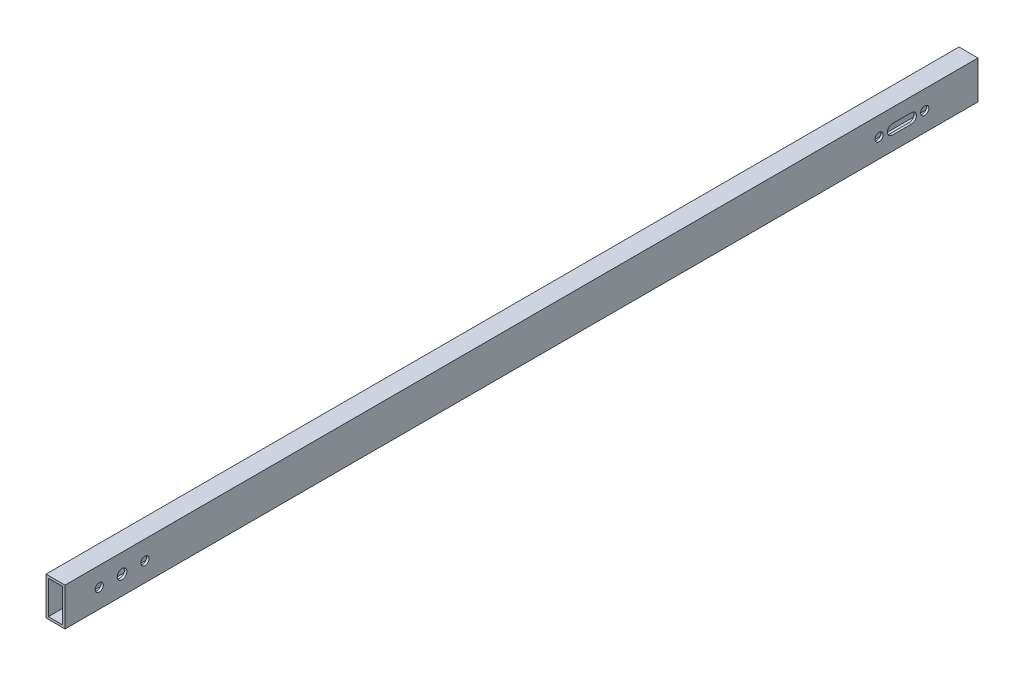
SolidWorks part; units mm, degrees
ref_plane "Front Plane" through (0, 0, 0) normal (0, 0, 1) x (1, 0, 0)
ref_plane "Top Plane" through (0, 0, 0) normal (0, 1, 0) x (1, 0, 0)
ref_plane "Right Plane" through (0, 0, 0) normal (1, 0, 0) x (0, 0, -1)
sketch "Sketch1" plane through (0, 0, 0) normal (0, 0, 1) x (1, 0, 0)
  line L1 (-6.35, -12.7) -> (6.35, -12.7)
  line L2 (-6.35, -12.7) -> (-6.35, 12.7)
  line L3 (-6.35, 12.7) -> (6.35, 12.7)
  line L4 (6.35, -12.7) -> (6.35, 12.7)
  line L6 (-6.35, 12.7) -> (6.35, -12.7) construction
  line L7 (-4.7625, -11.1125) -> (4.7625, -11.1125)
  line L8 (-4.7625, -11.1125) -> (-4.7625, 11.1125)
  line L9 (-4.7625, 11.1125) -> (4.7625, 11.1125)
  line L10 (4.7625, -11.1125) -> (4.7625, 11.1125)
  line L11 (-4.7625, -11.1125) -> (4.7625, 11.1125) construction
  line L12 (-4.7625, 11.1125) -> (4.7625, -11.1125) construction
  point P0 (0, 0)
  point P6 (0, 0)
  dimension "D1" = 25.4
  dimension "D2" = 1.5875
  dimension "D3" = 12.7
  dimension "D4" = 1.5875
  dimension "D5" = 1.5875
extrude "Boss-Extrude1" add sketch "Sketch1" along normal blind 609.6
sketch "Sketch2" plane through (6.35, 0, 0) normal (1, 0, 0) x (0, 0, -1)
  line L0 (-609.6, 0) -> (0, 0) construction
  line L1 (-609.6, -12.7) -> (-609.6, 12.7) construction
  line L2 (-571.5, 12.7) -> (-571.5, -12.7) construction
  line L3 (-44.45, 0) -> (-57.15, 0) construction
  line L4 (-44.45, -3.302) -> (-57.15, -3.302)
  line L5 (-44.45, 3.302) -> (-57.15, 3.302)
  line L6 (-609.6, 12.7) -> (0, 12.7) construction
  line L7 (-609.6, -12.7) -> (0, -12.7) construction
  line L8 (-50.8, 12.7) -> (-50.8, -12.7) construction
  circle A0 centre (-571.5, 0) radius 3.25
  arc A2 (-44.45, -3.302) -> (-44.45, 3.302) centre (-44.45, 0) ccw
  arc A3 (-57.15, 3.302) -> (-57.15, -3.302) centre (-57.15, 0) ccw
  circle A4 centre (-586.74, 0) radius 2.75
  circle A5 centre (-556.26, 0) radius 2.75
  circle A6 centre (-66.04, 0) radius 2.75
  circle A8 centre (-35.56, 0) radius 2.75
  point P9 (-50.8, 0)
  dimension "D1" = 6.5
  dimension "D2" = 3.302
  dimension "D6" = 5.5
  dimension "D8" = 30.48
  dimension "D3" = 38.1
  dimension "D4" = 12.7
  dimension "D5" = 520.7
  dimension "D7" = 30.48
extrude "Cut-Extrude1" cut sketch "Sketch2" against normal through all
sketch "Sketch3" plane through (0, 0, 609.6) normal (0, 0, 1) x (1, 0, 0)
  line L0 (-6.35, 12.7) -> (-6.35, -12.7) construction
  line L1 (-4.7625, 11.1125) -> (-6.35, 11.1125)
  line L2 (-4.7625, 11.1125) -> (-4.7625, -11.1125)
  line L3 (-4.7625, -11.1125) -> (-6.35, -11.1125)
  line L4 (-6.35, 11.1125) -> (-6.35, -11.1125)
  line L5 (-4.7625, -11.1125) -> (4.7625, -11.1125) construction
sketch "Sketch4" plane through (-6.35, 0, 0) normal (-1, 0, 0) x (0, 0, 1)
  line L0 (35.56, 0) -> (66.04, 0) construction
  line L1 (35.56, 5) -> (66.04, 5)
  line L2 (35.56, -5) -> (66.04, -5)
  line L3 (556.26, 0) -> (586.74, 0) construction
  line L4 (556.26, 5) -> (586.74, 5)
  line L5 (556.26, -5) -> (586.74, -5)
  arc A0 (35.56, 5) -> (35.56, -5) centre (35.56, 0) ccw
  arc A1 (66.04, -5) -> (66.04, 5) centre (66.04, 0) ccw
  arc A2 (556.26, 5) -> (556.26, -5) centre (556.26, 0) ccw
  arc A3 (586.74, -5) -> (586.74, 5) centre (586.74, 0) ccw
  point P2 (50.8, 0)
  point P13 (571.5, 0)
  dimension "D1" = 5
extrude "Cut-Extrude3" cut sketch "Sketch4" against normal up to next
sketch "Sketch5" plane through (0, -12.7, 0) normal (0, -1, 0) x (1, 0, 0)
  line L0 (-6.35, 609.6) -> (6.35, 609.6) construction
  line L1 (0, 609.6) -> (0, 0) construction
  line L2 (-6.35, 304.8) -> (6.35, 304.8) construction
  line L3 (-6.35, 609.6) -> (-6.35, 0) construction
  line L4 (6.35, 609.6) -> (6.35, 0) construction
  circle A0 centre (0, 596.9) radius 2.75
  circle A1 centre (0, 12.7) radius 2.75
  dimension "D1" = 5.5
  dimension "D2" = 12.7
extrude "Cut-Extrude5" cut sketch "Sketch5" against normal up to next
